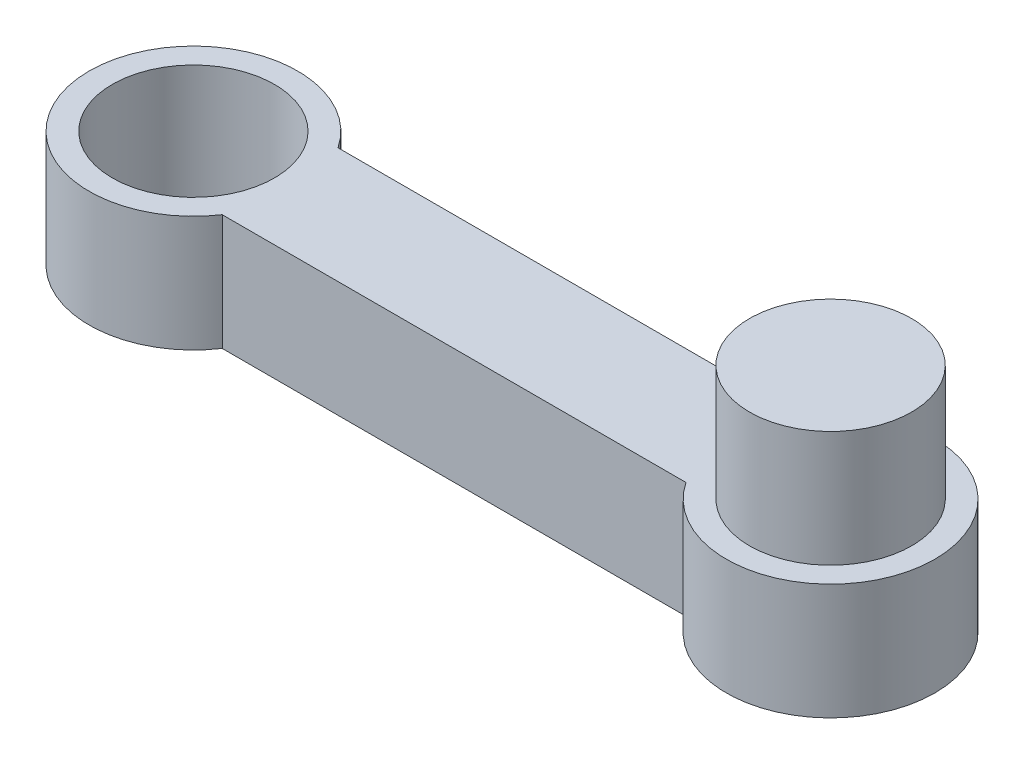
SolidWorks part; units mm, degrees
ref_plane "Front Plane" through (0, 0, 0) normal (0, 0, 1) x (1, 0, 0)
ref_plane "Top Plane" through (0, 0, 0) normal (0, 1, 0) x (1, 0, 0)
ref_plane "Right Plane" through (0, 0, 0) normal (1, 0, 0) x (0, 0, -1)
sketch "Sketch1" plane through (0, 0, 0) normal (0, 1, 0) x (1, 0, 0)
  line L0 (-242.6257, 275.7418) -> (-242.6257, 275.9924)
  line L1 (-242.6257, 175.9924) -> (157.3743, 175.9924)
  line L2 (-242.6257, 175.9924) -> (-242.6257, 176.2431)
  line L3 (-242.6257, 275.9924) -> (157.3743, 275.9924)
  line L4 (157.3743, 175.9924) -> (157.3743, 176.2431)
  line L5 (157.3743, 275.7418) -> (157.3743, 275.9924)
  arc A0 (-242.6257, 275.7418) -> (-242.6257, 176.2431) centre (-317.6257, 225.9924) ccw
  arc A1 (157.3743, 176.2431) -> (157.3743, 275.7418) centre (232.3743, 225.9924) ccw
  dimension "D3" = 180
  dimension "D6" = 180
  dimension "D1" = 400
  dimension "D2" = 100
  dimension "D4" = 50
  dimension "D5" = 75
  dimension "D7" = 75
  dimension "D8" = 50
extrude "Boss-Extrude1" add sketch "Sketch1" along normal blind 100
sketch "Sketch2" plane through (0, 100, 0) normal (0, 1, 0) x (1, 0, 0)
  circle A0 centre (-317.6257, 225.9924) radius 70
  dimension "D1" = 140
extrude "Cut-Extrude1" cut sketch "Sketch2" against normal blind 100
sketch "Sketch3" plane through (0, 100, 0) normal (0, 1, 0) x (1, 0, 0)
  circle A0 centre (232.3743, 225.9924) radius 70
  dimension "D1" = 140
extrude "Boss-Extrude2" add sketch "Sketch3" along normal blind 100
